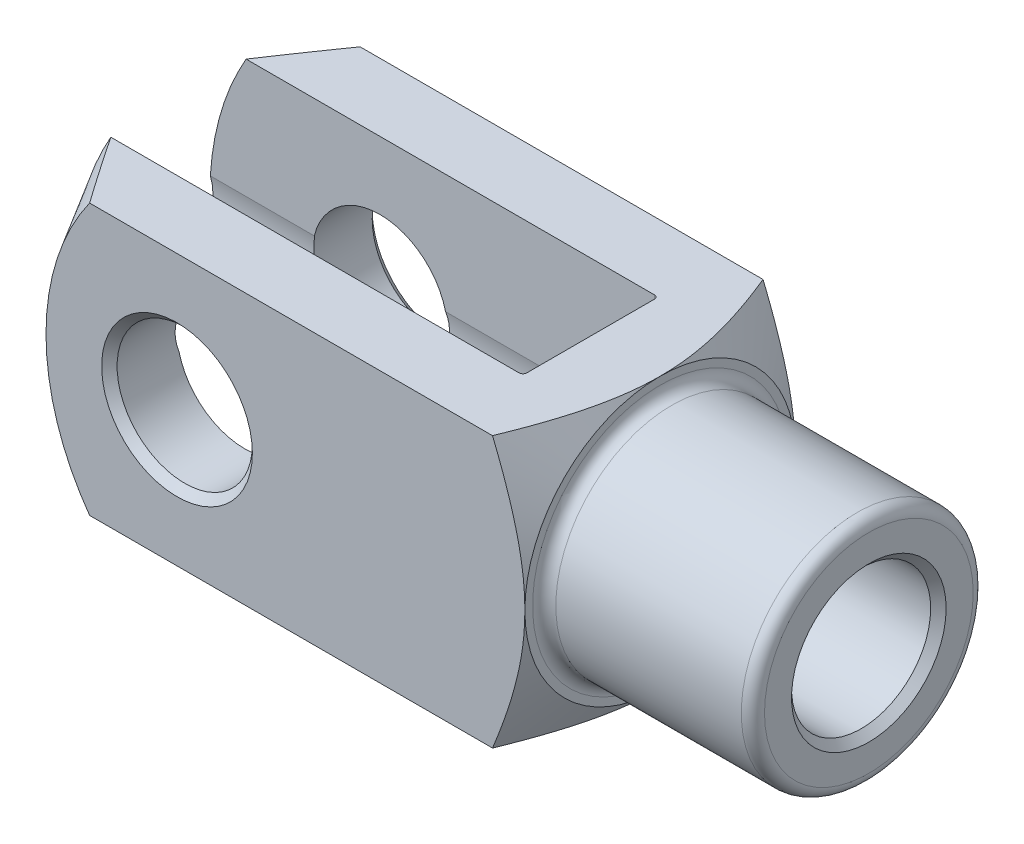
SolidWorks part; units mm, degrees
ref_plane "Front Plane" through (0, 0, 0) normal (0, 0, 1) x (1, 0, 0)
ref_plane "Top Plane" through (0, 0, 0) normal (0, 1, 0) x (1, 0, 0)
ref_plane "Right Plane" through (0, 0, 0) normal (1, 0, 0) x (0, 0, -1)
sketch "Sketch1" plane through (0, 0, 0) normal (1, 0, 0) x (0, 0, -1)
  line L0 (0, 0) -> (0, 50000) construction
  line L1 (0, 0) -> (50000, 0) construction
  line L2 (-35, -35) -> (-35, 35)
  line L3 (-35, 35) -> (35, 35)
  line L4 (35, -35) -> (35, 35)
  line L5 (-35, -35) -> (35, -35)
  point P9 (0, 35)
  point P11 (35, 0)
  point P12 (-35, 0)
  dimension "D1" = 70
  dimension "D2" = 70
extrude "Extrude1" add sketch "Sketch1" against normal blind 188
sketch "Sketch2" plane through (0, 0, 0) normal (1, 0, 0) x (0, 0, -1)
  circle A0 centre (0, 0) radius 30
  circle A1 centre (0, 0) radius 60
  dimension "D1" = 60
  dimension "D2" = 120
extrude "Extrude2" cut sketch "Sketch2" against normal blind 54
sketch "Sketch3" plane through (0, 0, 35) normal (0, 0, 1) x (1, 0, 0)
  circle A0 centre (-144, 0) radius 17.5
  dimension "D1" = 35
  dimension "D2" = 144
extrude "Extrude3" cut sketch "Sketch3" against normal through all
sketch "Sketch4" plane through (0, 35, 0) normal (0, 1, 0) x (1, 0, 0)
  line L0 (0, 0) -> (-50000, 0) construction
  line L1 (-188, -17.5) -> (-188, 17.5)
  line L2 (-188, 35) -> (-188, -35) construction
  line L3 (-188, 17.5) -> (-72, 17.5)
  line L4 (-72, 17.5) -> (-72, -17.5)
  line L5 (-144, 35) -> (-144, -35) construction
  line L6 (-188, -17.5) -> (-72, -17.5)
  point P7 (-144, 0)
  point P13 (-72, 0)
  point P14 (-188, 0)
  dimension "D1" = 72
  dimension "D2" = 35
extrude "Extrude4" cut sketch "Sketch4" against normal through all
fillet "Fillet1" radius 1 2 edges at (-72, 0, 17.5) (-72, 0, -17.5)
fillet "Fillet2" radius 3 2 edges at (0, 0, -30) (-54, 0, -30)
chamfer "Chamfer2" distance 2 angle 45 2 edges at (-126.5, 0, -35) (-126.5, 0, 35)
sketch "Sketch6" plane through (0, 0, 0) normal (0, 0, 1) x (1, 0, 0)
  line L0 (-54, -35) -> (-54, -70)
  line L1 (-54, -70) -> (-74.2073, -70)
  line L2 (-74.2073, -70) -> (-54, -35)
  dimension "D1" = 30
  dimension "D2" = 70
revolve "Cut-Revolve1" cut sketch "Sketch6" angle 360 about axis through (-54, 0, 0) along (1, 0, 0)
sketch "Sketch7" plane through (0, 0, 0) normal (0, 1, 0) x (1, 0, 0)
  line L0 (-177.8964, -35) -> (-188, -17.5)
  line L1 (-188, 17.5) -> (-177.8964, 35)
  line L2 (-177.8964, 35) -> (-258, 35)
  line L3 (-188, 17.5) -> (-188, -17.5)
  line L4 (-258, 35) -> (-258, -35)
  line L5 (-258, -35) -> (-177.8964, -35)
  line L6 (-188, 35) -> (-62.3701, 35) construction
  line L7 (-188, -35) -> (-62.3701, -35) construction
  line L8 (-118, 0.6162) -> (-118, 50000.6162) construction
  dimension "D1" = 120
  dimension "D2" = 70
  dimension "D3" = 70
revolve "Cut-Revolve2" cut sketch "Sketch7" angle 180 about L8
sketch "Sketch8" plane through (0, 0, 0) normal (1, 0, 0) x (0, 0, -1)
  circle A0 centre (0, 0) radius 18
  dimension "D1" = 36
extrude "Extrude5" cut sketch "Sketch8" against normal through all
chamfer "Chamfer3" distance 2 angle 45 1 edges at (0, 0, -18)
equation "\"D2@Sketch1\" = \"D1@Sketch1\""
equation "\"D2@Sketch2\" = \"D1@Sketch2\"*2"
equation "\"D2@Sketch6\" = \"D1@Sketch1\""
equation "\"D2@Sketch7\" = \"D1@Sketch1\""
equation "\"D3@Sketch7\" = \"D1@Sketch1\""
